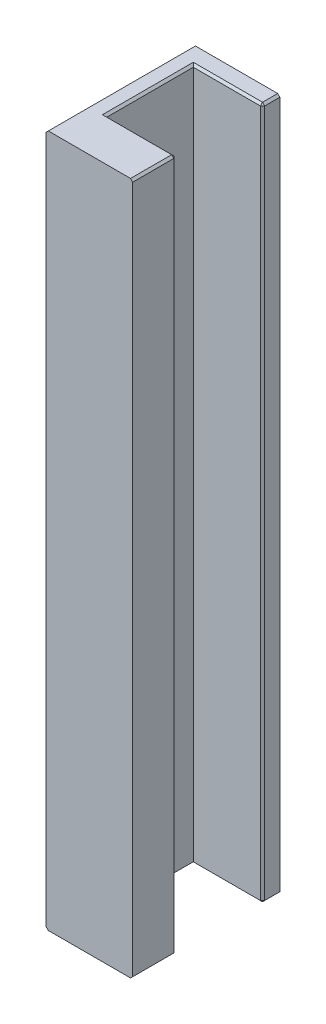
SolidWorks part; units mm, degrees
ref_plane "Front Plane" through (0, 0, 0) normal (0, 0, 1) x (1, 0, 0)
ref_plane "Top Plane" through (0, 0, 0) normal (0, 1, 0) x (1, 0, 0)
ref_plane "Right Plane" through (0, 0, 0) normal (1, 0, 0) x (0, 0, -1)
sketch "Sketch1" plane through (0, 0, 0) normal (0, 1, 0) x (1, 0, 0)
  line L1 (-1, 5) -> (1, 5)
  line L2 (-1, 5) -> (-1, -5)
  line L3 (-1, -5) -> (1, -5)
  line L4 (1, 5) -> (1, -5)
  line L5 (-1, 5) -> (1, -5) construction
  line L6 (-1, -5) -> (1, 5) construction
  line L7 (-1, 5) -> (9, 5)
  line L8 (-1, 5) -> (-1, 7)
  line L9 (-1, 7) -> (9, 7)
  line L10 (9, 5) -> (9, 7)
  line L11 (-1, 5) -> (9, 7) construction
  line L12 (-1, 7) -> (9, 5) construction
  line L13 (-1, -5) -> (9, -5)
  line L14 (-1, -5) -> (-1, -10)
  line L15 (-1, -10) -> (9, -10)
  line L16 (9, -5) -> (9, -10)
  line L17 (-1, -5) -> (9, -10) construction
  line L18 (-1, -10) -> (9, -5) construction
  point P0 (0, 0)
  point P9 (4, 6)
  point P13 (4, -7.5)
  dimension "D1" = 10
  dimension "D2" = 5
  dimension "D3" = 2
  dimension "D4" = 2
  dimension "D5" = 10
  dimension "D6" = 10
extrude "Boss-Extrude1" add sketch "Sketch1" along normal blind 80 contours L16 L13 L3 L14 L15 | L4 L1 L2 L3 | L7 L10 L9 L8 L1
chamfer "Chamfer1" distance 0.25 angle 45 14 edges at (-1, 0, 1.5) (-1, 80, 1.5) (9, 0, 7.5) (9, 0, -6) (9, 80, -6) (9, 80, 7.5) (5, 0, -5) (5, 80, -5) (1, 0, 0) (1, 80, 0) (5, 0, 5) (5, 80, 5) (9, 40, 5) (9, 40, -5)
